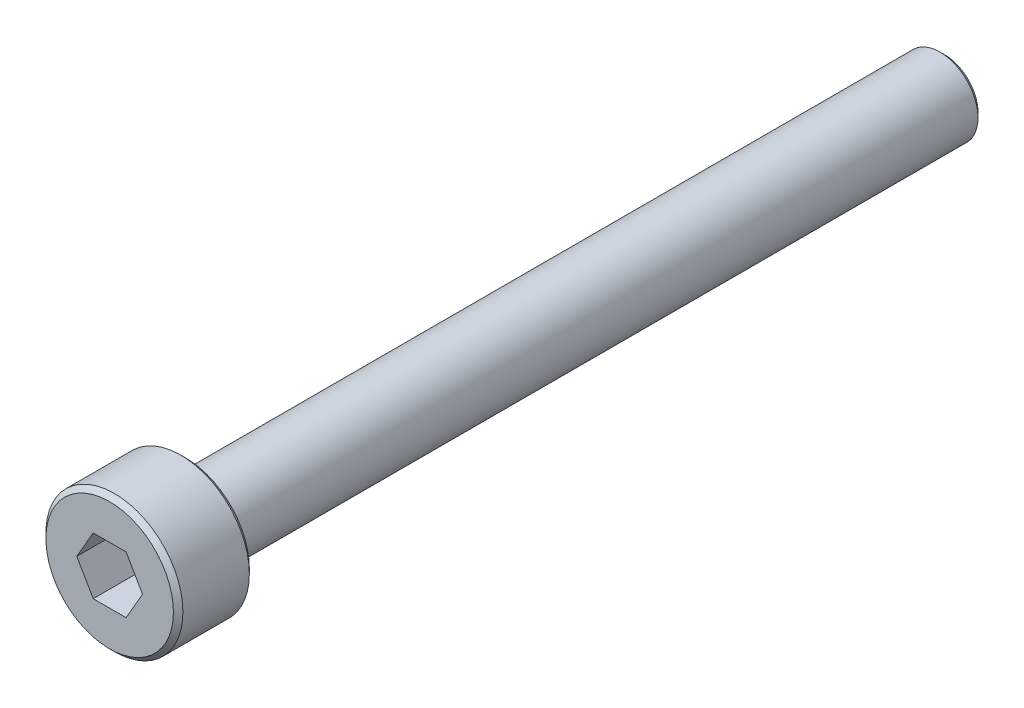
SolidWorks part; units mm, degrees
ref_plane "Front Plane" through (0, 0, 0) normal (1, 0, 0) x (0, 1, 0)
ref_plane "Top Plane" through (0, 0, 0) normal (0, 0, 1) x (0, 1, 0)
ref_plane "Right Plane" through (0, 0, 0) normal (0, 1, 0) x (-1, 0, 0)
sketch "Sketch1" plane through (0, 0, 0) normal (0, 0, 1) x (0, 1, 0)
  circle A0 centre (0, 0) radius 2
  dimension "D1" = 4
extrude "Boss-Extrude1" add sketch "Sketch1" along normal blind 40
sketch "Sketch2" plane through (0, 0, 40) normal (0, 0, 1) x (1, 0, 0)
  circle A0 centre (0, 0) radius 3.61
  dimension "D1" = 7.22
extrude "Boss-Extrude2" add sketch "Sketch2" along normal blind 4
sketch "Sketch3" plane through (0, 0, 44) normal (0, 0, 1) x (1, 0, 0)
  line L1 (1.7321, 0) -> (0.866, 1.5)
  line L2 (0.866, 1.5) -> (-0.866, 1.5)
  line L3 (-0.866, 1.5) -> (-1.7321, 0)
  line L4 (-1.7321, 0) -> (-0.866, -1.5)
  line L5 (-0.866, -1.5) -> (0.866, -1.5)
  line L6 (0.866, -1.5) -> (1.7321, 0)
  circle A0 centre (0, 0) radius 1.5 construction
  dimension "D1" = 3
extrude "Cut-Extrude1" cut sketch "Sketch3" against normal blind 2.5
chamfer "Chamfer1" distance 0.25 angle 45 3 edges at (2, 0, 0) (3.61, 0, 40) (3.61, 0, 44)
